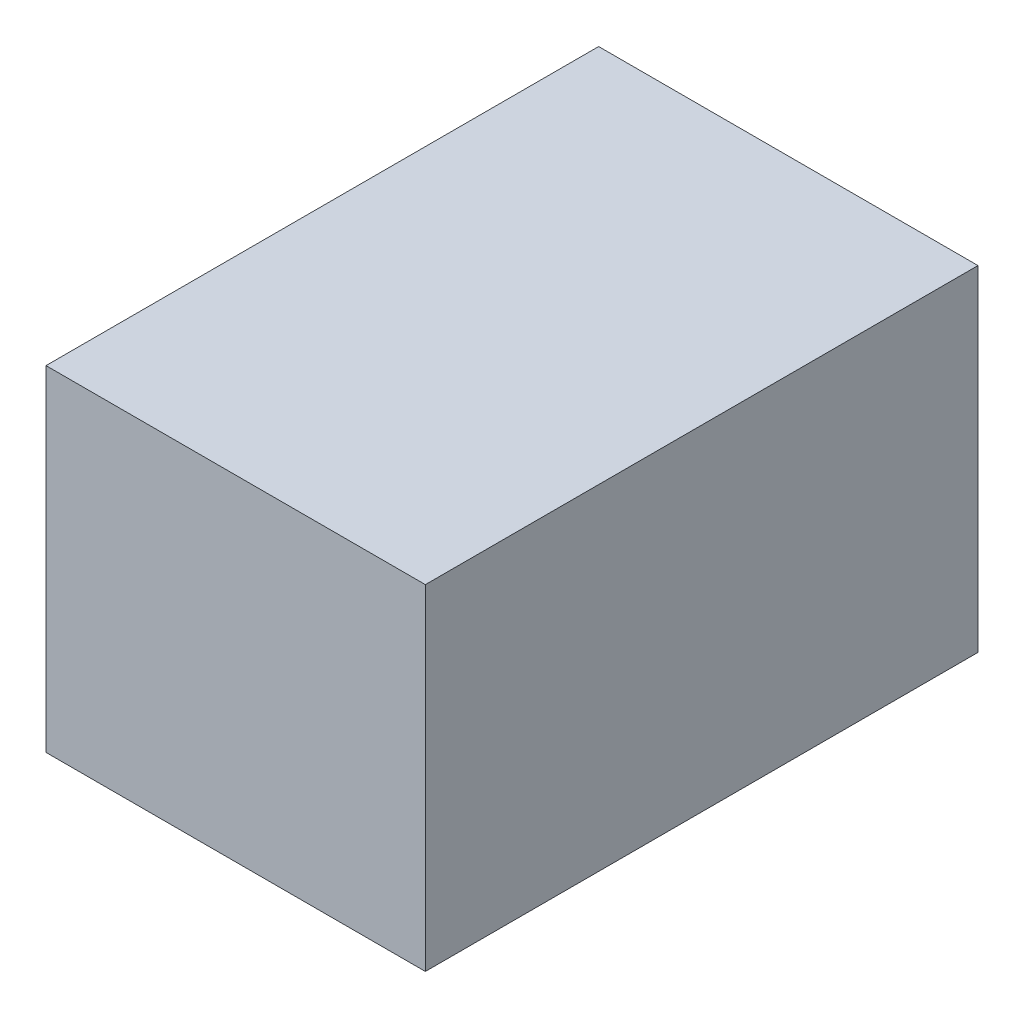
SolidWorks part; units mm, degrees
ref_plane "Front Plane" through (0, 0, 0) normal (0, 0, 1) x (1, 0, 0)
ref_plane "Top Plane" through (0, 0, 0) normal (0, 1, 0) x (1, 0, 0)
ref_plane "Right Plane" through (0, 0, 0) normal (1, 0, 0) x (0, 0, -1)
sketch "Sketch1" plane through (0, 0, 0) normal (0, 0, 1) x (1, 0, 0)
  line L1 (-102.9668, 90.9341) -> (102.9668, 90.9341)
  line L2 (-102.9668, 90.9341) -> (-102.9668, -90.9341)
  line L3 (-102.9668, -90.9341) -> (102.9668, -90.9341)
  line L4 (102.9668, 90.9341) -> (102.9668, -90.9341)
  line L5 (-102.9668, 90.9341) -> (102.9668, -90.9341) construction
  line L6 (-102.9668, -90.9341) -> (102.9668, 90.9341) construction
  point P0 (0, 0)
extrude "Boss-Extrude1" add sketch "Sketch1" along normal blind 300
sketch "Sketch2" plane through (0, 0, 300) normal (0, 0, 1) x (1, 0, 0)
  line L0 (-102.9668, 0) -> (102.9668, 0)
  line L1 (-102.9668, 90.9341) -> (-102.9668, -90.9341) construction
  line L2 (102.9668, -90.9341) -> (102.9668, 90.9341) construction
other "Cavity1"
other "model1<1>@Assem11"
